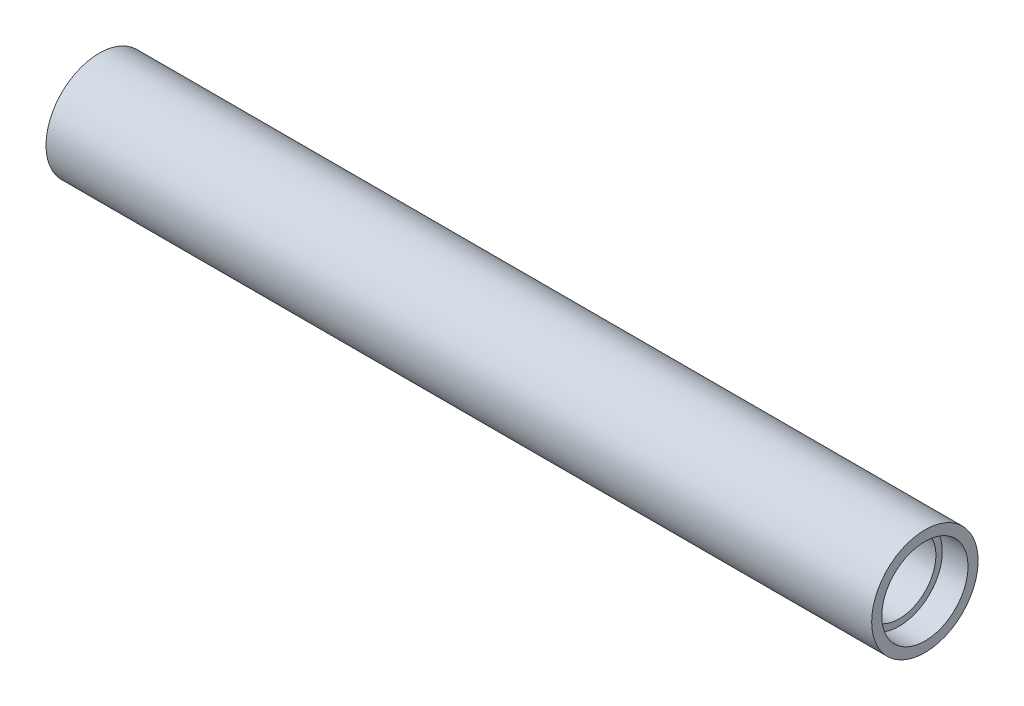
SolidWorks part; units mm, degrees
ref_plane "Plan de face" through (0, 0, 0) normal (0, 0, 1) x (1, 0, 0)
ref_plane "Plan de dessus" through (0, 0, 0) normal (0, 1, 0) x (1, 0, 0)
ref_plane "Plan de droite" through (0, 0, 0) normal (1, 0, 0) x (0, 0, -1)
sketch "Esquisse1" plane through (0, 0, 0) normal (0, 0, 1) x (1, 0, 0)
  line L0 (-301.8352, 0) -> (261.8303, 0) construction
  line L1 (-211, 20) -> (211, 20)
  line L2 (-225, 23.5) -> (-225, 29)
  line L3 (-225, 29) -> (225, 29)
  line L4 (225, 23.5) -> (225, 29)
  line L5 (-225, 23.5) -> (-211, 23.5)
  line L6 (-211, 23.5) -> (-211, 20)
  line L7 (211, 20) -> (211, 23.5)
  line L8 (211, 23.5) -> (225, 23.5)
  point P0 (0, 20)
  dimension "D1" = 450
  dimension "D2" = 40
  dimension "D3" = 58
  dimension "D4" = 47
  dimension "D5" = 14
revolve "Révolution1" add sketch "Esquisse1" angle 360 about L0
